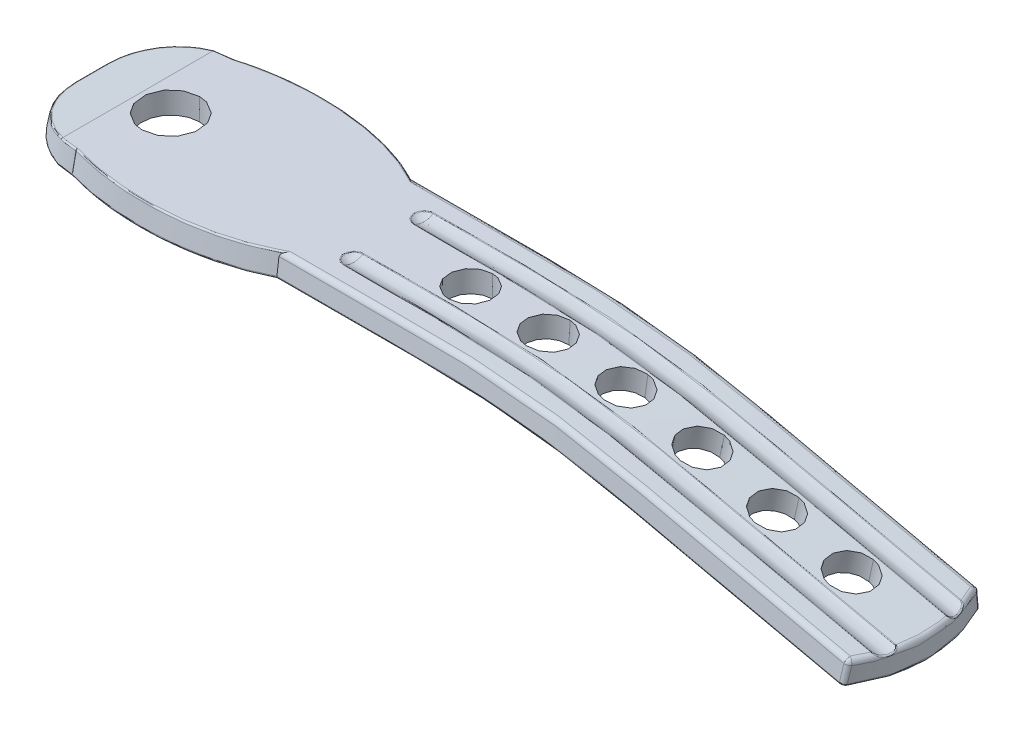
SolidWorks part; units mm, degrees
ref_plane "Face" through (0, 0, 0) normal (0, 0, 1) x (1, 0, 0)
ref_plane "Dessus" through (0, 0, 0) normal (0, 1, 0) x (1, 0, 0)
ref_plane "Droite" through (0, 0, 0) normal (1, 0, 0) x (0, 0, -1)
sketch "Esquisse1" plane through (0, 0, 0) normal (0, 1, 0) x (1, 0, 0)
  line L0 (-41.5579, 0) -> (207.5575, 0) construction
  line L1 (-21.5408, 17) -> (50.4318, 17) construction
  line L2 (-43.8792, 15) -> (39.7524, 15) construction
  line L3 (-43.8792, -15) -> (39.7524, -15) construction
  line L4 (-15, 3) -> (-15, -3)
  line L5 (32, 12.5) -> (137, 12.5)
  line L6 (-21.5408, -17) -> (50.4318, -17) construction
  line L7 (32, -12.5) -> (137, -12.5)
  arc A0 (-3, 15) -> (-15, 3) centre (-3, 3) ccw
  arc A1 (-15, -3) -> (-3, -15) centre (-3, -3) ccw
  arc A2 (137, -12.5) -> (137, 12.5) centre (112.4583, 0) ccw
  ellipse E0 centre (11.343, 0) end of major axis (-19.1359, 0) minor radius 17 (32, 12.5) -> (-3, 15) ccw
  ellipse E1 centre (11.343, 0) end of major axis (-19.1359, 0) minor radius 17 (-3, -15) -> (32, -12.5) ccw
  point P30 (140, 0)
  dimension "D1" = 30
  dimension "D2" = 15
  dimension "D3" = 6
  dimension "D4" = 25
  dimension "D5" = 35
  dimension "D6" = 34
  dimension "D7" = 105
  dimension "D8" = 3
extrude "Extrusion1" add sketch "Esquisse1" along normal blind 4 draft 10
sketch "Esquisse2" plane through (0, 4, 0) normal (0, 1, 0) x (1, 0, 0)
  circle A0 centre (0, 0) radius 5.25
  dimension "D1" = 10.5
extrude "Extrusion2" cut sketch "Esquisse2" against normal through all
sketch "Esquisse3" plane through (0, 4, 0) normal (0, 1, 0) x (1, 0, 0)
  circle A0 centre (55, 0) radius 4
  dimension "D1" = 8
  dimension "D2" = 55
extrude "Extrusion3" cut sketch "Esquisse3" against normal through all
pattern_linear "Répétition linéaire1" count 6 spacing 14 along (1, 0, 0) of "Extrusion3"
ref_plane "Plan1" through (40, 0, 0) normal (1, 0, 0) x (0, 0, -1)
sketch "Esquisse4" plane through (40, 0, 0) normal (1, 0, 0) x (0, 0, -1)
  line L0 (11.7947, 4) -> (-11.7947, 4) construction
  line L1 (-4.65, 4) -> (-8.15, 4)
  line L2 (-6.4, -1.6148) -> (-6.4, 7.623) construction
  line L3 (-12.5, 0) -> (12.5, 0) construction
  arc A0 (-8.15, 4) -> (-4.65, 4) centre (-6.4, 6.8125) ccw
  point P6 (-6.4, 3.5)
  dimension "D2" = 3.5
  dimension "D1" = 6.4
  dimension "D3" = 3.5
extrude "Extrusion4" cut sketch "Esquisse4" along normal through all
sketch "Esquisse5" plane through (40, 0, 0) normal (1, 0, 0) x (0, 0, -1)
  line L0 (-4.65, 4) -> (-8.15, 4) construction
  line L1 (-4.65, 4) -> (-6.4, 4)
  line L2 (-6.4, 5.1671) -> (-6.4, 2.0496) construction
  line L3 (-6.4, 4) -> (-6.4, 3.5)
  arc A0 (-8.15, 4) -> (-4.65, 4) centre (-6.4, 6.8125) ccw construction
  arc A1 (-6.4, 3.5) -> (-4.65, 4) centre (-6.4, 6.8125) ccw
revolve "Enlèvement de matière-Révolution1" cut sketch "Esquisse5" angle 180 about L2
mirror "Symétrie1" about plane through (0, 0, 0) normal (0, 0, 1) of "Enlèvement de matière-Révolution1", "Extrusion4"
sketch "Esquisse6" plane through (0, 0, 0) normal (0, 0, 1) x (1, 0, 0)
  line L0 (-6, 4) -> (-14.4269, 3.25)
  line L1 (-2.8988, 4) -> (-14.2947, 4) construction
  line L2 (-6, 0) -> (-14.8678, 0.75)
  line L3 (-15, 0) -> (-3, 0) construction
  line L4 (-15, 0) -> (-6, 0)
  line L5 (-6, 4) -> (-14.2947, 4)
  line L6 (-14.2947, 4) -> (-15, 0) construction
  line L7 (-14.2947, 4) -> (-14.4269, 3.25)
  line L8 (-14.8678, 0.75) -> (-15, 0)
  dimension "D1" = 9
  dimension "D2" = 2.5
  dimension "D3" = 0.75
extrude "Extrusion5" cut sketch "Esquisse6" against normal through all and the other way through all
fillet "Congé1" radius 1 5 edges at (84.1966, 4, -11.7947) (84.1966, 4, 11.7947) (137.3623, 4, 9.9992)
fillet "Congé2" radius 0.3 26 edges at (38.25, 4, -6.4) (89.0182, 4, -4.65) (88.5725, 4, -8.15) (138.6626, 3.5809, -5.6725) (138.6436, 3.5399, 5.8877) (89.0182, 4, 4.65) (88.5725, 4, 8.15) (38.25, 4, 6.4) (-12.3976, 0.5411, 10.3079) (-14.8678, 0.75, 0) (84.1944, 0, 12.5) (136.8149, 0, 12.4036) (140, 0, 0) (137.0046, 0, -12.2843) (6.637, 0, 16.7961) (-12.3976, 0.5411, -10.3079) (-4.5121, 0, -14.9044) (22.7197, 0, -15.7712) (84.1944, 0, -12.5) (-12.0742, 3.4594, -9.8841) (-14.4269, 3.25, 0) (22.5586, 4, -15.0845) (-12.0742, 3.4594, 9.8841) (-4.4635, 4, 14.1995) (24.6172, 4, 14.572) (-4.4635, 4, -14.1995)
sketch "Esquisse7" plane through (0, 0, 0) normal (0, 1, 0) x (1, 0, 0)
  line L0 (-6, -0.0032) -> (139.6425, 0)
  line L1 (-6, -14.2558) -> (-6, 14.2493) construction
  arc A0 (136.9714, -11.7511) -> (136.9714, 11.7511) centre (112.4583, 0) ccw construction
sketch "Esquisse8" plane through (0, 0, 0) normal (0, 0, 1) x (1, 0, 0)
  line L0 (-6.57, -5.1447) -> (57.9405, -5.1447)
  line L1 (93.7288, -9.0641) -> (136.8234, -18.618)
  arc A0 (93.7288, -9.0641) -> (57.9405, -5.1447) centre (57.9405, -170.4947) ccw
  dimension "D3" = 330.7
  dimension "D2" = 12.5
other "Déformer1" parameters "D1"=50, "D2"=50
